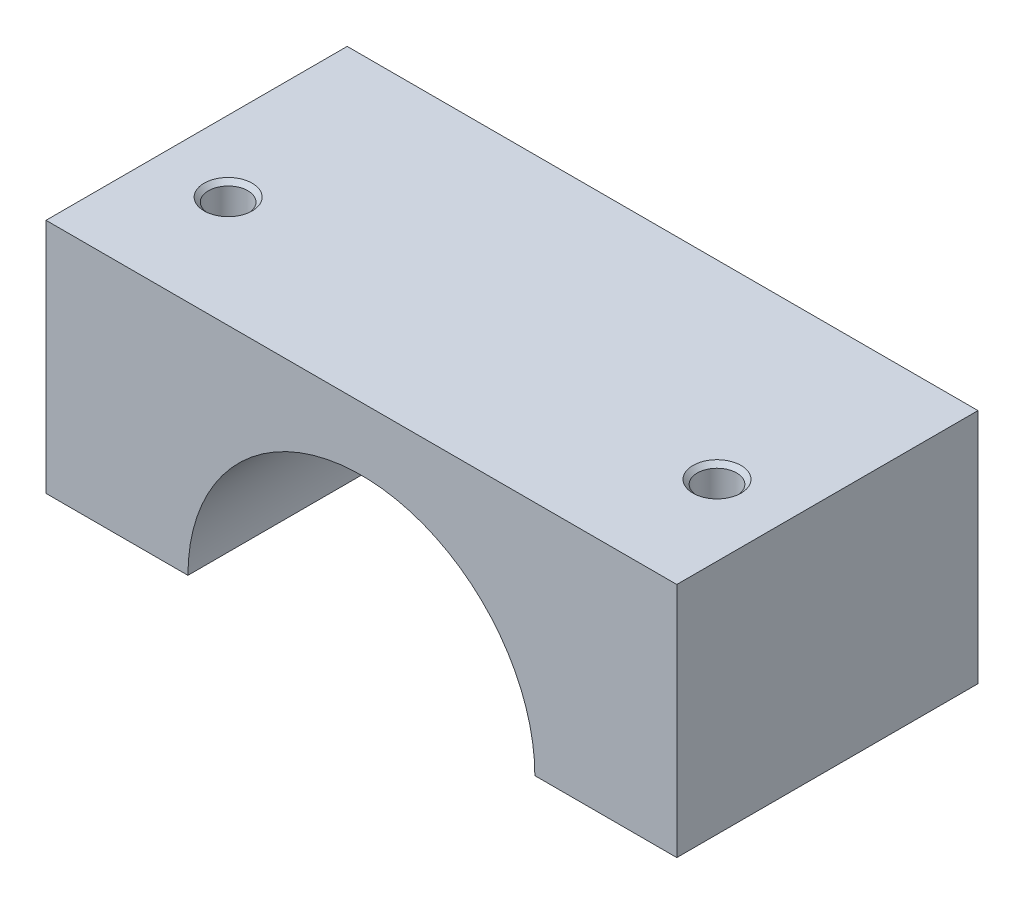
SolidWorks part; units mm, degrees
ref_plane "前视基准面" through (0, 0, 0) normal (0, 0, 1) x (1, 0, 0)
ref_plane "上视基准面" through (0, 0, 0) normal (0, 1, 0) x (1, 0, 0)
ref_plane "右视基准面" through (0, 0, 0) normal (1, 0, 0) x (0, 0, -1)
other "Configuration Table"
sketch "草图1" plane through (0, 0, 0) normal (0, 0, 1) x (1, 0, 0)
  line L0 (-11, 0) -> (-20, 0)
  line L1 (-20, 0) -> (-20, 15)
  line L2 (-20, 15) -> (20, 15)
  line L3 (20, 15) -> (20, 0)
  line L4 (20, 0) -> (11, 0)
  arc A0 (11, 0) -> (-11, 0) centre (0, 0) ccw
  dimension "D2" = 11
  dimension "D1" = 40
  dimension "D3" = 15
extrude "凸台-拉伸1" add sketch "草图1" along normal blind 19.1
sketch "草图2" plane through (0, 15, 0) normal (0, 1, 0) x (1, 0, 0)
  line L0 (20, -19.1) -> (-20, -19.1) construction
  point P5 (-15.5, -12.05)
  point P9 (15.5, -12.05)
  dimension "D1" = 7.05
  dimension "D2" = 7.05
hole_wizard "M3 螺纹孔1" positions "草图2" profile "草图3" tap size "M3" standard "GB"
sketch "草图3" plane through (-15.5, 15, 12.05) normal (1, 0, 0) x (0, 0, 1)
  line L0 (0, 0) -> (0, 27.5)
  line L1 (0, 27.5) -> (1.25, 26.7489)
  line L2 (1.25, 26.7489) -> (1.25, 0.275)
  line L3 (1.25, 0.275) -> (1.525, 0)
  line L5 (1.525, 0) -> (0, 0)
  line L6 (-1.25, 0.275) -> (-1.525, 0) construction
  line L10 (0, 27.5) -> (-1.25, 26.7489) construction
  line L11 (0, -6.35) -> (0, 107.95) construction
  dimension "螺纹孔钻头直径" = 2.5
  dimension "螺纹孔钻头深度" = 27.5
  dimension "近端锥形沉头孔直径" = 3.05
  dimension "近端锥形沉头孔角度" = 90
  dimension "导头角度" = 118
